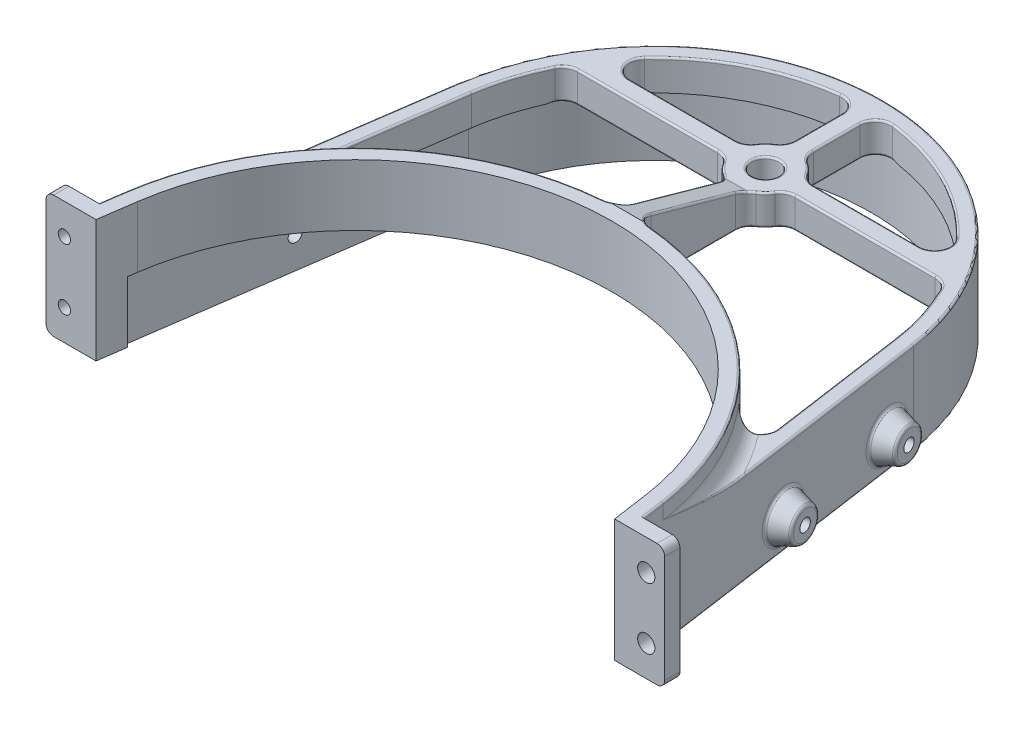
SolidWorks part; units mm, degrees
ref_plane "Front Plane" through (0, 0, 0) normal (0, 0, 1) x (1, 0, 0)
ref_plane "Top Plane" through (0, 0, 0) normal (0, 1, 0) x (1, 0, 0)
ref_plane "Right Plane" through (0, 0, 0) normal (1, 0, 0) x (0, 0, -1)
sketch "Sketch1" plane through (0, 0, 0) normal (0, 1, 0) x (1, 0, 0)
  line L0 (-94.2861, 13.5166) -> (-113.0315, -117.2437)
  line L1 (-88.0003, 12.6155) -> (-107.5269, -123.5937)
  line L2 (-107.5269, -123.5937) -> (-128.2715, -123.5937)
  line L3 (-128.2715, -123.5937) -> (-128.2715, -117.2437)
  line L4 (-128.2715, -117.2437) -> (-113.0315, -117.2437)
  line L5 (0, 0) -> (0, 32.657) construction
  line L6 (94.2861, 13.5166) -> (113.0315, -117.2437)
  line L7 (88.0003, 12.6155) -> (107.5269, -123.5937)
  line L8 (128.2715, -117.2437) -> (113.0315, -117.2437)
  line L9 (128.2715, -123.5937) -> (128.2715, -117.2437)
  line L10 (107.5269, -123.5937) -> (128.2715, -123.5937)
  line L12 (-93.4143, -25.1504) -> (-88.0003, 12.6155) construction
  arc A0 (88.0003, 12.6155) -> (-88.0003, 12.6155) centre (0, 0) ccw
  arc A1 (94.2861, 13.5166) -> (-94.2861, 13.5166) centre (0, 0) ccw
  dimension "D1" = 6.35
  dimension "D2" = 6.35
  dimension "D3" = 15.24
extrude "Boss-Extrude1" add sketch "Sketch1" against normal blind 38.1
sketch "Sketch2" plane through (0, -38.1, 0) normal (0, -1, 0) x (1, 0, 0)
  line L6 (89.5718, -12.8407) -> (109.0983, 123.3684)
  line L7 (-109.0983, 123.3684) -> (-89.5718, -12.8407)
  line L8 (89.5718, -12.8407) -> (109.0983, 123.3684)
  line L9 (-109.0983, 123.3684) -> (-89.5718, -12.8407)
  line L12 (-107.5269, 123.5937) -> (-109.1306, 123.5937)
  line L14 (88.0003, -12.6155) -> (107.5269, 123.5937)
  line L15 (-107.5269, 123.5937) -> (-88.0003, -12.6155)
  line L16 (88.0003, -12.6155) -> (107.5269, 123.5937)
  line L17 (-107.5269, 123.5937) -> (-88.0003, -12.6155)
  line L18 (-109.0983, 123.3684) -> (-109.1306, 123.5937)
  line L19 (-128.2715, 123.5937) -> (-107.5269, 123.5937) construction
  line L20 (107.5269, 123.5937) -> (109.1306, 123.5937)
  line L21 (107.5269, 123.5937) -> (128.2715, 123.5937) construction
  line L22 (109.1306, 123.5937) -> (109.0983, 123.3684)
  arc A3 (-89.5718, -12.8407) -> (89.5718, -12.8407) centre (0, 0) ccw
  arc A4 (-89.5718, -12.8407) -> (89.5718, -12.8407) centre (0, 0) ccw
  arc A7 (-88.0003, -12.6155) -> (88.0003, -12.6155) centre (0, 0) ccw
  arc A8 (-88.0003, -12.6155) -> (88.0003, -12.6155) centre (0, 0) ccw
  dimension "D1" = 1.5875
  dimension "D2" = 0
extrude "Cut-Extrude1" cut sketch "Sketch2" against normal offset from surface (25.4 mm away) 12.7
sketch "Sketch3" plane through (0, -12.7, 0) normal (0, -1, 0) x (1, 0, 0)
  line L0 (113.0315, 117.2437) -> (128.2715, 117.2437)
  line L1 (128.2715, 117.2437) -> (128.2715, 123.5937)
  line L2 (128.2715, 123.5937) -> (128.2715, 117.2437) construction
  line L3 (107.5269, 123.5937) -> (88.0003, -12.6155) construction
  line L4 (109.1306, 123.5937) -> (128.2715, 123.5937) construction
  line L5 (-107.5269, 123.5937) -> (-105.3616, 108.4894)
  line L6 (0, 0) -> (0, 122.7925) construction
  line L7 (-113.0315, 117.2437) -> (-111.6473, 107.5883)
  line L9 (-128.2715, 123.5937) -> (-107.5269, 123.5937)
  line L10 (128.2715, 123.5937) -> (107.5269, 123.5937)
  line L11 (113.0315, 117.2437) -> (111.6473, 107.5883)
  line L12 (107.5269, 123.5937) -> (105.3616, 108.4894)
  line L13 (-128.2715, 117.2437) -> (-128.2715, 123.5937)
  line L14 (-113.0315, 117.2437) -> (-128.2715, 117.2437)
  arc A0 (-105.3616, 108.4894) -> (105.3616, 108.4894) centre (0, 123.5937) ccw
  arc A1 (-111.6473, 107.5883) -> (111.6473, 107.5883) centre (0, 123.5937) ccw
  arc A2 (-105.287, 164.0405) -> (111.6473, 107.5883) centre (0, 123.5937) ccw construction
  arc A4 (-99.3593, 161.7633) -> (105.3616, 108.4894) centre (0, 123.5937) ccw construction
  circle A5 centre (0, 123.5937) radius 106.4387 construction
  dimension "D1" = 6.35
extrude "Boss-Extrude2" add sketch "Sketch3" against normal blind 25.4
sketch "Sketch19" plane through (38.7856, -38.1, -725.5022) normal (0, 1, 0) x (0.212, 0, -0.9773)
  line L0 (-849.5079, -34.6055) -> (-849.3949, -36.189) construction
  line L1 (-861.1546, -35.4363) -> (-849.5079, -34.6055)
  line L3 (-849.5079, -34.6055) -> (-849.3949, -36.189)
  line L5 (-849.3949, -36.189) -> (-860.8146, -37.0036)
  line L6 (-861.1546, -35.4363) -> (-723.6747, -25.6293) construction
  line L7 (-860.8146, -37.0036) -> (-861.1546, -35.4363)
  line L8 (-865.212, -16.7305) -> (-861.1546, -35.4363) construction
  line L9 (-845.5946, -35.9179) -> (-860.8146, -37.0036) construction
  point P7 (0, 0)
extrude "Boss-Extrude6" add sketch "Sketch19" along normal up to surface (25.4 mm away)
mirror "Mirror2" about plane through (0, 0, 0) normal (1, 0, 0) of "Boss-Extrude6"
sketch "Sketch5" plane through (0, 12.7, 0) normal (0, 1, 0) x (1, 0, 0)
  line L0 (-12.115, 42.6521) -> (-80.9029, 42.6521)
  line L1 (-3.81, 95.1738) -> (3.81, 95.1738)
  line L2 (-3.81, 95.1738) -> (-3.81, 58.5771)
  line L3 (-3.81, -17.155) -> (3.81, -17.155)
  line L4 (3.81, 95.1738) -> (3.81, 58.5771)
  line L5 (-3.81, 95.1738) -> (3.81, -17.155) construction
  line L6 (-3.81, -17.155) -> (3.81, 95.1738) construction
  line L7 (80.9029, 42.6521) -> (12.115, 42.6521)
  line L8 (80.9029, 42.6521) -> (80.9029, 50.2721)
  line L9 (80.9029, 50.2721) -> (12.115, 50.2721)
  line L10 (-80.9029, 42.6521) -> (-80.9029, 50.2721)
  line L11 (80.9029, 42.6521) -> (-80.9029, 50.2721) construction
  line L12 (80.9029, 50.2721) -> (-80.9029, 42.6521) construction
  line L13 (-3.81, 34.347) -> (-3.81, -17.155)
  line L17 (3.81, 34.347) -> (3.81, -17.155)
  line L19 (-12.115, 50.2721) -> (-80.9029, 50.2721)
  arc A0 (105.3616, -108.4894) -> (-105.3616, -108.4894) centre (0, -123.5937) ccw construction
  arc A1 (94.2861, 13.5166) -> (-94.2861, 13.5166) centre (0, 0) ccw construction
  arc A2 (12.115, 50.2721) -> (3.81, 58.5771) centre (0, 46.4621) ccw
  arc A3 (3.81, 34.347) -> (12.115, 42.6521) centre (0, 46.4621) ccw
  arc A4 (-3.81, 58.5771) -> (-12.115, 50.2721) centre (0, 46.4621) ccw
  arc A5 (-12.115, 42.6521) -> (-3.81, 34.347) centre (0, 46.4621) ccw
  circle A7 centre (0, 46.4621) radius 40.0177 construction
  point P0 (0, 39.0094)
  dimension "D3" = 12.7
  dimension "D1" = 7.62
  dimension "D2" = 7.62
extrude "Boss-Extrude3" add sketch "Sketch5" against normal up to surface (25.4 mm away)
sketch "Sketch7" plane through (0, 0, 0) normal (1, 0, 0) x (0, 0, -1)
  line L0 (-10.8693, 12.7) -> (95.25, 12.7)
  line L1 (95.25, 12.7) -> (95.25, 0)
  line L2 (95.25, -38.1) -> (95.25, 0) construction
  line L3 (95.25, 0) -> (34.347, 0)
  line L4 (34.347, 0) -> (-10.8693, 12.7)
  line L5 (-10.8693, 12.7) -> (34.347, 12.7) construction
  line L7 (88.8183, 0) -> (50.2721, 0) construction
  line L8 (34.347, -12.7) -> (34.347, 12.7) construction
extrude "Cut-Extrude3" cut sketch "Sketch7" against normal through all both and the other way through all
fillet "Fillet1" radius 6.35 20 edges at (107.3793, 0, 89.083) (-107.3793, 0, 89.083) (100.0669, -6.35, 71.5562) (-100.0669, -6.35, 71.5562) (-3.81, -6.35, -34.347) (-12.115, -6.35, -42.6521) (-12.115, -6.35, -50.2721) (-3.81, -6.35, -58.5771) (3.81, -6.35, -58.5771) (12.115, -6.35, -50.2721) (12.115, -6.35, -42.6521) (3.81, -6.35, -34.347) (3.81, 0, 10.8693) (-3.81, 0, 10.8693) (-78.0001, -6.35, -42.6521) (-73.3207, -6.35, -50.2721) (-3.81, -6.35, -88.8183) (3.81, -6.35, -88.8183) (73.3207, -6.35, -50.2721) (78.0001, -6.35, -42.6521)
hole_wizard "7/16 (0.4375) Diameter Hole1" positions "Sketch8" profile "Sketch9" hole size "7/16" standard "ANSI Inch"
sketch "Sketch8" plane through (0, 0, 0) normal (0, 1, 0) x (1, 0, 0)
  arc A0 (-6.7733, 57.2051) -> (-10.743, 53.2354) centre (0, 46.4621) ccw construction
  point P0 (0, 46.4621)
sketch "Sketch9" plane through (0, 0, -46.4621) normal (1, 0, 0) x (0, 0, 1)
  line L0 (0, 0) -> (0, 38.1)
  line L1 (0, 38.1) -> (5.5562, 38.1)
  line L2 (5.5562, 38.1) -> (5.5562, 0)
  line L5 (5.5562, 0) -> (0, 0)
  line L11 (0, -6.35) -> (0, 107.95) construction
  dimension "Thru Hole Dia." = 11.1125
  dimension "Thru Hole Depth" = 38.1
hole_wizard "1/4-20 Tapped Hole1" positions "Sketch10" profile "Sketch11" tap size "1/4-20" standard "ANSI Inch"
sketch "Sketch10" plane through (0, 0, 117.2437) normal (0, 0, -1) x (-1, 0, 0)
  line L0 (120.6515, 0) -> (120.6515, -25.4) construction
  line L2 (120.6515, -12.7) -> (128.2715, -12.7) construction
  line L3 (128.2715, -38.1) -> (128.2715, 12.7) construction
  line L5 (120.6515, 0) -> (120.6515, 12.7) construction
  line L6 (128.2715, 12.7) -> (113.0315, 12.7) construction
  point P0 (120.6515, 0)
  point P2 (120.6515, -25.4)
  dimension "D1" = 25.4
sketch "Sketch11" plane through (-120.6515, 0, 117.2437) normal (1, 0, 0) x (0, 1, 0)
  line L0 (0, 0) -> (0, 6.35)
  line L1 (0, 6.35) -> (2.5527, 6.35)
  line L2 (2.5527, 6.35) -> (2.5527, 0)
  line L5 (2.5527, 0) -> (0, 0)
  line L11 (0, -6.35) -> (0, 107.95) construction
  dimension "Thread Major Dia." = 5.1054
  dimension "Thru Tap Drill Depth" = 6.35
hole_wizard "9/32 (0.28125) Diameter Hole2" positions "Sketch17" profile "Sketch18" hole size "9/32" standard "ANSI Inch"
sketch "Sketch17" plane through (0, 0, 117.2437) normal (0, 0, -1) x (-1, 0, 0)
  line L0 (0, 0) -> (0, 53.966) construction
  point P0 (-120.6515, 0)
  point P2 (-120.6515, -25.4)
sketch "Sketch18" plane through (120.6515, 0, 117.2437) normal (1, 0, 0) x (0, 1, 0)
  line L0 (0, 0) -> (0, 6.35)
  line L1 (0, 6.35) -> (3.5719, 6.35)
  line L2 (3.5719, 6.35) -> (3.5719, 0)
  line L5 (3.5719, 0) -> (0, 0)
  line L11 (0, -6.35) -> (0, 107.95) construction
  dimension "Thru Hole Dia." = 7.1437
  dimension "Thru Hole Depth" = 6.35
hole_wizard "1/4-20 Tapped Hole2" positions "Sketch12" profile "Sketch13" tap size "1/4-20" standard "ANSI Inch"
sketch "Sketch12" plane through (-89.5718, 0, -12.8407) normal (0.9899, 0, 0.1419) x (0.1419, 0, -0.9899)
  line L0 (0, -38.1) -> (-132.097, -38.1) construction
  line L1 (-132.097, -38.1) -> (-132.097, 12.7) construction
  point P0 (-12.7, -25.4)
  point P2 (-63.5, -25.4)
  dimension "D1" = 12.7
  dimension "D2" = 68.597
  dimension "D3" = 50.8
sketch "Sketch13" plane through (-91.374, -25.4, -0.2693) normal (0, 1, 0) x (0.1419, 0, -0.9899)
  line L0 (0, 0) -> (0, 50.0024)
  line L1 (0, 50.0024) -> (2.5527, 50.0024)
  line L2 (2.5527, 50.0024) -> (2.5527, 0)
  line L5 (2.5527, 0) -> (0, 0)
  line L11 (0, -6.35) -> (0, 107.95) construction
  dimension "Thread Major Dia." = 5.1054
  dimension "Thru Tap Drill Depth" = 50.0024
sketch "Sketch20" plane through (-94.2861, 0, -13.5166) normal (-0.9899, 0, -0.1419) x (-0.1419, 0, 0.9899)
  circle A0 centre (12.7, -25.4) radius 9.525
  circle A1 centre (63.5, -25.4) radius 9.525
  dimension "D1" = 19.05
extrude "Boss-Extrude8" add sketch "Sketch20" along normal blind 7.9375
chamfer "Chamfer1" distance 7.9375 angle 20 2 edges at (-112.506, -25.4, 57.6431) (-105.2971, -25.4, 7.3571)
hole_wizard "1/4-20 Tapped Hole3" positions "Sketch21" profile "Sketch22" tap size "1/4-20" standard "ANSI Inch"
sketch "Sketch21" plane through (-102.1433, 0, -14.6429) normal (-0.9899, 0, -0.1419) x (-0.1419, 0, 0.9899)
  point P0 (12.7, -25.4)
  point P3 (63.5, -25.4)
sketch "Sketch22" plane through (-103.9455, -25.4, -2.0715) normal (0, 1, 0) x (-0.1419, 0, 0.9899)
  line L0 (0, 0) -> (0, 7.9375)
  line L1 (0, 7.9375) -> (2.5527, 7.9375)
  line L2 (2.5527, 7.9375) -> (2.5527, 0)
  line L5 (2.5527, 0) -> (0, 0)
  line L11 (0, -6.35) -> (0, 107.95) construction
  dimension "Thread Major Dia." = 5.1054
  dimension "Thru Tap Drill Depth" = 7.9375
fillet "Fillet6" radius 1.27 4 edges at (-112.096, -25.4, 54.7833) (-104.6488, -25.4, 58.7694) (-104.8871, -25.4, 4.4974) (-97.4399, -25.4, 8.4835)
mirror "Mirror1" about plane through (0, 0, 0) normal (1, 0, 0) of "Fillet6", "1/4-20 Tapped Hole3", "Chamfer1", "Boss-Extrude8", "1/4-20 Tapped Hole2"
fillet "Fillet3" radius 3.175 4 edges at (-128.2715, 12.7, 120.4187) (-128.2715, -38.1, 120.4187) (128.2715, 12.7, 120.4187) (128.2715, -38.1, 120.4187)
fillet "Fillet4" radius 0.762 56 edges at (4.9697, 12.0478, 8.5472) (-4.9697, 12.0478, 8.5472) (3.81, 6.0718, -12.7293) (-3.81, 6.0718, -12.7293) (4.1749, 0.5274, -32.4692) (-4.1749, 0.5274, -32.4692) (-91.0366, 0.8181, 51.6687) (108.0037, 1.0283, 82.1718) (-108.0037, 1.0283, 82.1718) (91.0366, 0.8181, 51.6687) (-103.6588, -38.1, 51.8636) (0, 0, -95.25) (0, -38.1, -95.25) (8.8106, 12.7, 11.0939) (112.3394, 12.7, 112.416) (13.0472, 0, -51.062) (38.0924, 0, -50.2721) (65.9004, 0, -54.1056) (40.1954, 0, -79.294) (5.9553, 0, -86.6808) (3.81, 0, -72.2495) (4.6, 0, -59.5092) (8.9803, 0, -55.4423) (-4.6, 0, -59.5092) (-3.81, 0, -72.2495) (-5.9553, 0, -86.6808) (-40.1954, 0, -79.294) (-65.9004, 0, -54.1056) (-38.0924, 0, -50.2721) (-13.0472, 0, -51.062) (-8.9803, 0, -55.4423) (92.0957, 0, 15.9519) (84.9594, 0, -26.1748) (77.5003, 0, -41.6898) (45.127, 0, -42.6521) (13.0472, 0, -41.8621) (8.9803, 0, -37.4818) (5.9444, 0, -35.0963) (0, 0, -34.347) (-5.9444, 0, -35.0963) (-8.9803, 0, -37.4818) (-13.0472, 0, -41.8621) (-45.127, 0, -42.6521) (-77.5003, 0, -41.6898) (-84.9594, 0, -26.1748) (-92.0957, 0, 15.9519) (-95.8263, 0, 47.7146) (-100.2438, 0, 28.0419) (100.2438, 0, 28.0419) (95.8263, 0, 47.7146) (0, 0, -40.9058) (103.6588, -38.1, 51.8636) (77.4484, 12.7, 41.5996) (-112.3394, 12.7, 112.416) (-8.8106, 12.7, 11.0939) (-77.4484, 12.7, 41.5996)
fillet "Fillet5" radius 0.762 32 edges at (-65.9004, -12.7, -54.1056) (-5.9553, -12.7, -86.6808) (-3.81, -12.7, -72.2495) (-4.6, -12.7, -59.5092) (-8.9803, -12.7, -55.4423) (-13.0472, -12.7, -51.062) (-38.0924, -12.7, -50.2721) (4.6, -12.7, -59.5092) (3.81, -12.7, -72.2495) (5.9553, -12.7, -86.6808) (8.9803, -12.7, -55.4423) (13.0472, -12.7, -51.062) (38.0924, -12.7, -50.2721) (65.9004, -12.7, -54.1056) (-77.5003, -12.7, -41.6898) (-45.127, -12.7, -42.6521) (-13.0472, -12.7, -41.8621) (-8.9803, -12.7, -37.4818) (-4.6, -12.7, -33.4149) (-3.81, -12.7, -12.7293) (-5.4823, -12.7, 9.1834) (-51.104, -12.7, 23.0468) (-92.5469, -12.7, 51.1947) (92.5469, -12.7, 51.1947) (51.104, -12.7, 23.0468) (5.4823, -12.7, 9.1834) (3.81, -12.7, -12.7293) (4.6, -12.7, -33.4149) (8.9803, -12.7, -37.4818) (45.127, -12.7, -42.6521) (13.0472, -12.7, -41.8621) (77.5003, -12.7, -41.6898)
